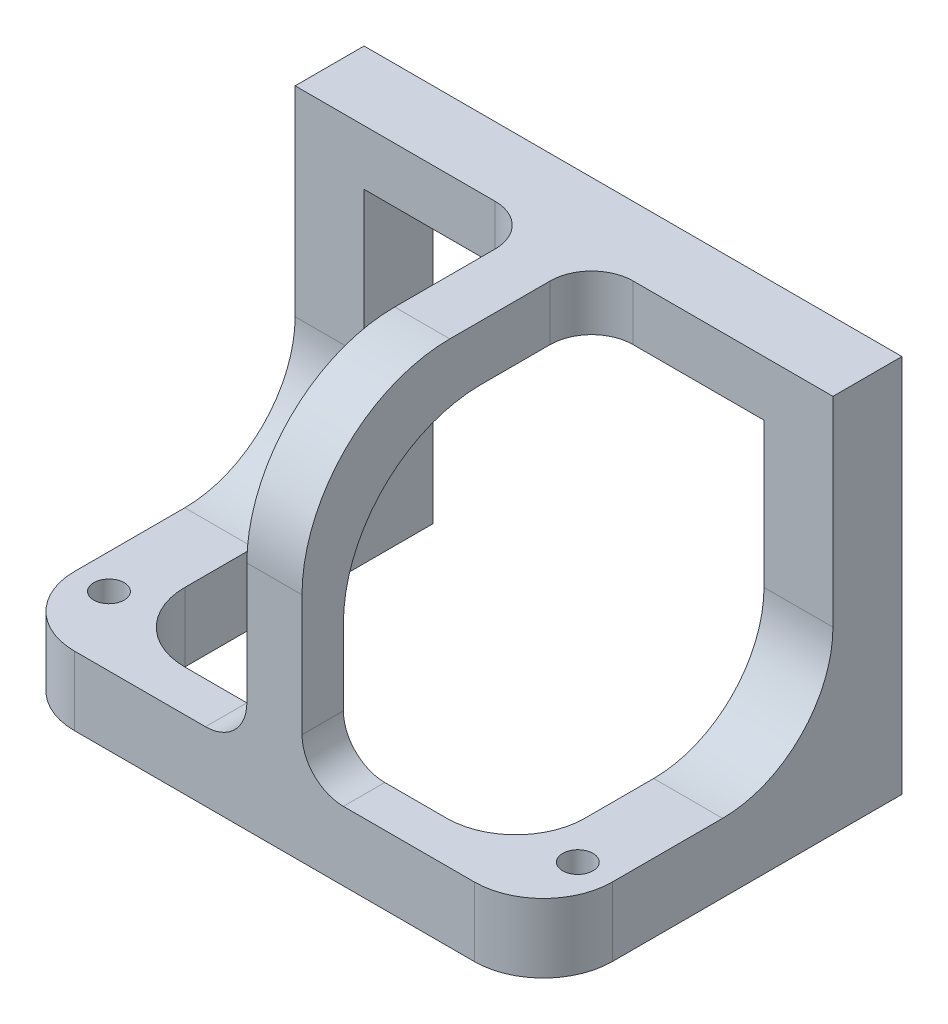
SolidWorks part; units mm, degrees
ref_plane "前视基准面" through (0, 0, 0) normal (0, 0, 1) x (1, 0, 0)
ref_plane "上视基准面" through (0, 0, 0) normal (0, 1, 0) x (1, 0, 0)
ref_plane "右视基准面" through (0, 0, 0) normal (1, 0, 0) x (0, 0, -1)
sketch "草图1" plane through (0, 0, 0) normal (0, 0, 1) x (1, 0, 0)
  line L0 (-14.5, 23.5) -> (14.5, 23.5)
  line L1 (14.5, 23.5) -> (14.5, 0)
  line L2 (14.5, 0) -> (25.5, 0)
  line L3 (25.5, 0) -> (25.5, 4)
  line L4 (25.5, 4) -> (19.5, 4)
  line L5 (19.5, 4) -> (19.5, 27.5)
  line L6 (19.5, 27.5) -> (-19.5, 27.5)
  line L7 (0, 0) -> (0, 33.4615) construction
  line L8 (-19.5, 4) -> (-19.5, 27.5)
  line L9 (-25.5, 4) -> (-19.5, 4)
  line L10 (-25.5, 0) -> (-25.5, 4)
  line L11 (-14.5, 0) -> (-25.5, 0)
  line L12 (-14.5, 23.5) -> (-14.5, 0)
  point P12 (0, 27.5)
  point P17 (0, 23.5)
  dimension "D1" = 29
  dimension "D2" = 23.5
  dimension "D3" = 4
  dimension "D4" = 5
  dimension "D5" = 4
  dimension "D6" = 6
extrude "凸台-拉伸1" add sketch "草图1" along normal blind 5
sketch "草图2" plane through (0, 4, 0) normal (0, 1, 0) x (1, 0, 0)
  line L0 (19.5, 0) -> (25.5, -5) construction
  line L1 (0, 0) -> (0, -7.4854) construction
  circle A0 centre (22.5, -2.5) radius 1.35
  circle A1 centre (-22.5, -2.5) radius 1.35
  dimension "D1" = 2.7
extrude "切除-拉伸1" cut sketch "草图2" against normal through all
ref_plane "基准面1" through (0, 0, 0) normal (1, 0, 0) x (0, 0, -1)
sketch "草图3" plane through (0, 0, 0) normal (1, 0, 0) x (0, 0, -1)
  line L0 (-5, 23.5) -> (-13, 23.5)
  line L1 (-23, 13.5) -> (-23, 0)
  line L2 (-5, 27.5) -> (-15.2839, 27.5)
  line L3 (-26, 0) -> (-26, 16.7839)
  line L4 (-23, 0) -> (-26, 0)
  line L6 (-5, 27.5) -> (-5, 23.5)
  line L9 (-5, 0) -> (-5, 4) construction
  line L10 (-5, 27.5) -> (0, 27.5) construction
  line L12 (-5, 27.5) -> (0, 27.5) construction
  arc A0 (-13, 23.5) -> (-23, 13.5) centre (-13, 13.5) ccw
  arc A2 (-15.2839, 27.5) -> (-26, 16.7839) centre (-15.2839, 16.7839) ccw
  point P1 (-5, 2)
  dimension "D2" = 4
  dimension "D4" = 10
  dimension "D1" = 3
  dimension "D3" = 18
  dimension "D5" = 27.5
extrude "凸台-拉伸2" add sketch "草图3" along normal mid plane 4
sketch "草图4" plane through (0, 0, 5) normal (0, 0, 1) x (1, 0, 0)
  line L0 (14.5, 23.5) -> (14.5, 0) construction
  line L1 (14.5, 5) -> (19.5, 5)
  line L2 (14.5, 5) -> (14.5, 0)
  line L3 (14.5, 0) -> (19.5, 0)
  line L4 (19.5, 5) -> (19.5, 0)
  line L5 (19.5, 4) -> (19.5, 27.5) construction
  line L7 (14.5, 0) -> (25.5, 0) construction
  dimension "D1" = 5
extrude "凸台-拉伸3" add sketch "草图4" along normal up to surface (21 mm away)
sketch "草图5" plane through (14.5, 0, 0) normal (-1, 0, 0) x (0, 0, 1)
  line L0 (26, 0) -> (0, 0) construction
  line L1 (26, 5) -> (23, 5)
  line L2 (26, 5) -> (26, 0)
  line L3 (26, 0) -> (23, 0)
  line L4 (23, 5) -> (23, 0)
  dimension "D1" = 3
extrude "凸台-拉伸4" add sketch "草图5" along normal up to surface (16.5 mm away)
mirror "镜向1" about plane through (0, 0, 0) normal (1, 0, 0) of "凸台-拉伸4", "凸台-拉伸3"
sketch "草图6" plane through (0, 0, 5) normal (0, 0, 1) x (1, 0, 0)
  line L4 (25.5, 4) -> (19.5, 4)
  line L5 (19.5, 4) -> (19.5, 0)
  line L6 (19.5, 0) -> (25.5, 0)
  line L7 (25.5, 0) -> (25.5, 4)
  line L8 (25.5, 4) -> (19.5, 4)
  line L9 (19.5, 4) -> (19.5, 0)
  line L10 (19.5, 0) -> (25.5, 0)
  line L11 (25.5, 0) -> (25.5, 4)
  line L12 (-19.5, 0) -> (-19.5, 4)
  line L13 (-19.5, 4) -> (-25.5, 4)
  line L14 (-25.5, 4) -> (-25.5, 0)
  line L15 (-25.5, 0) -> (-19.5, 0)
  line L16 (-19.5, 0) -> (-19.5, 4)
  line L17 (-19.5, 4) -> (-25.5, 4)
  line L18 (-25.5, 4) -> (-25.5, 0)
  line L19 (-25.5, 0) -> (-19.5, 0)
  dimension "D1" = 0
  dimension "D2" = 0
extrude "切除-拉伸2" [suppressed] cut sketch "草图6" against normal through all
fillet "圆角1" [suppressed] radius 4
sketch "草图8" plane through (0, 0, 5) normal (0, 0, 1) x (1, 0, 0)
  line L4 (-19.5, 0) -> (-19.5, 4)
  line L5 (-19.5, 4) -> (-25.5, 4)
  line L6 (-25.5, 4) -> (-25.5, 0)
  line L7 (-25.5, 0) -> (-19.5, 0)
  line L8 (-19.5, 0) -> (-19.5, 4)
  line L9 (-19.5, 4) -> (-25.5, 4)
  line L10 (-25.5, 4) -> (-25.5, 0)
  line L11 (-25.5, 0) -> (-19.5, 0)
  line L12 (25.5, 4) -> (19.5, 4)
  line L13 (19.5, 4) -> (19.5, 0)
  line L14 (19.5, 0) -> (25.5, 0)
  line L15 (25.5, 0) -> (25.5, 4)
  line L16 (25.5, 4) -> (19.5, 4)
  line L17 (19.5, 4) -> (19.5, 0)
  line L18 (19.5, 0) -> (25.5, 0)
  line L19 (25.5, 0) -> (25.5, 4)
  dimension "D1" = 0
  dimension "D2" = 0
extrude "切除-拉伸3" cut sketch "草图8" against normal through all
sketch "草图9" plane through (0, 5, 0) normal (0, 1, 0) x (1, 0, 0)
  line L0 (-17, -5) -> (-17, -21.8052) construction
  line L1 (-19.5, -5) -> (-14.5, -5) construction
  line L2 (0, -26) -> (0, 5.1245) construction
  line L3 (2, -26) -> (-2, -26) construction
  line L4 (0, -11.55) -> (0, 11.55) construction
  line L5 (-2, -24.5) -> (-23.6487, -24.5) construction
  line L6 (-2, -23) -> (-2, -26) construction
  line L7 (-2, -23) -> (-14.5, -23) construction
  line L8 (-19.5, 0) -> (-14.5, 0) construction
  line L9 (-19.5, 0) -> (-14.5, 0) construction
  line L10 (-14.5, -5) -> (-19.5, 0) construction
  circle A0 centre (-17, -2.5) radius 1
  circle A1 centre (17, -2.5) radius 1
  circle A2 centre (-17, -21) radius 1.1
  circle A3 centre (17, -21) radius 1.1
  dimension "D1" = 2
  dimension "D2" = 2.2
  dimension "D3" = 2
extrude "切除-拉伸4" cut sketch "草图9" against normal through all
fillet "圆角2" radius 5 4 edges at (-14.5, 2.5, 23) (19.5, 2.5, 26) (14.5, 2.5, 23) (-19.5, 2.5, 26)
sketch "草图10" plane through (0, 5, 0) normal (0, -1, 0) x (1, 0, 0)
  circle A1 centre (-17, 2.5) radius 1
  circle A2 centre (-17, 2.5) radius 1
  circle A3 centre (17, 2.5) radius 1
  circle A4 centre (17, 2.5) radius 1
  dimension "D1" = 0
  dimension "D2" = 0
extrude "切除-拉伸5" cut sketch "草图10" against normal blind 6
fillet "圆角3" radius 8 2 edges at (17, 5, 5) (-17, 5, 5)
fillet "圆角4" radius 3 4 edges at (2, 5, 24.5) (-2, 5, 24.5)
